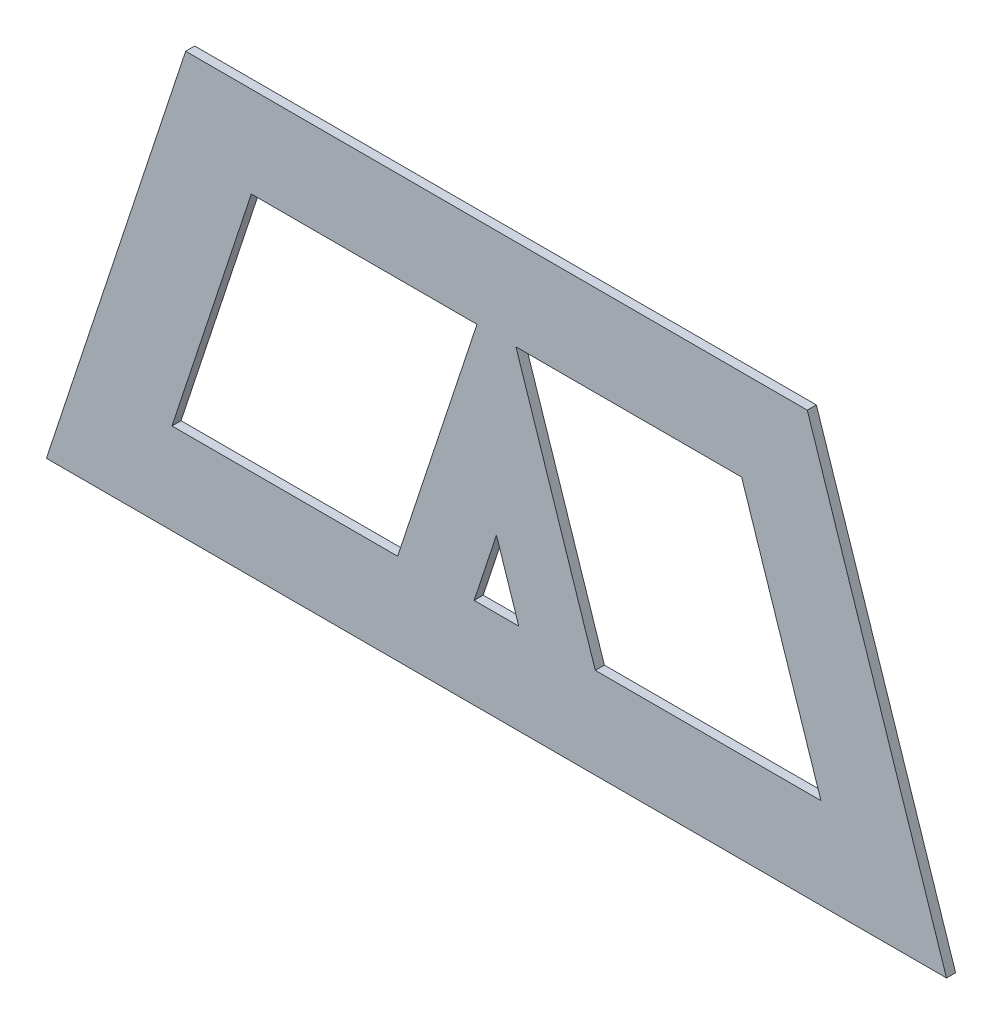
SolidWorks part; units mm, degrees
ref_plane "Front Plane" through (0, 0, 0) normal (0, 0, 1) x (1, 0, 0)
ref_plane "Top Plane" through (0, 0, 0) normal (0, 1, 0) x (1, 0, 0)
ref_plane "Right Plane" through (0, 0, 0) normal (1, 0, 0) x (0, 0, -1)
sketch "Model" plane through (0, 0, 0) normal (0, 0, 1) x (1, 0, 0)
  line L0 (36.9534, 1041.5557) -> (30.5303, 1061.0287)
  line L1 (-38.8663, 1041.5557) -> (-38.8663, 1061.0287)
  line L2 (-114.686, 1041.5557) -> (-108.2629, 1061.0287)
  line L3 (132.5637, 548.977) -> (-25.2382, 548.977)
  line L4 (-265.779, 380.7697) -> (-210.2963, 548.977)
  line L5 (-265.779, 380.7697) -> (-107.9771, 380.7697)
  line L6 (188.0463, 380.7697) -> (132.5637, 548.977)
  line L7 (-54.485, 380.7697) -> (-38.8663, 428.1209)
  line L8 (30.2445, 380.7697) -> (-25.2382, 548.977)
  line L9 (-107.9771, 380.7697) -> (-52.4945, 548.977)
  line L11 (-353.5894, 317.2697) -> (-256.2163, 612.477)
  line L12 (275.8568, 317.2697) -> (178.4836, 612.477)
  line L13 (45.7285, 333.8266) -> (-9.7541, 502.0339) construction
  line L14 (-123.4611, 333.8266) -> (-67.9785, 502.0339) construction
  line L15 (-52.4945, 548.977) -> (-210.2963, 548.977)
  line L16 (132.5637, 548.977) -> (-210.2963, 548.977) construction
  line L17 (30.2445, 380.7697) -> (188.0463, 380.7697)
  line L18 (-265.779, 380.7697) -> (188.0463, 380.7697) construction
  line L20 (-23.2477, 380.7697) -> (-38.8663, 428.1209)
  line L21 (-54.485, 380.7697) -> (-23.2477, 380.7697)
  line L23 (-59.7338, 364.8568) -> (-4.2511, 533.0641) construction
  line L25 (-17.9988, 364.8568) -> (-73.4815, 533.0641) construction
  line L27 (-353.5894, 317.2697) -> (275.8568, 317.2697)
  line L28 (178.4836, 612.477) -> (-256.2163, 612.477)
  line L31 (-114.686, 1041.5557) -> (36.9534, 1041.5557)
  line L32 (-108.2629, 1061.0287) -> (30.5303, 1061.0287)
  dimension "D1" = 63.5
  dimension "D2" = 149.86
  dimension "D3" = 149.86
  dimension "D4" = 50.8
  dimension "D7" = 50.8
extrude "Boss-Extrude1" add sketch "Model" along normal blind 6.35
